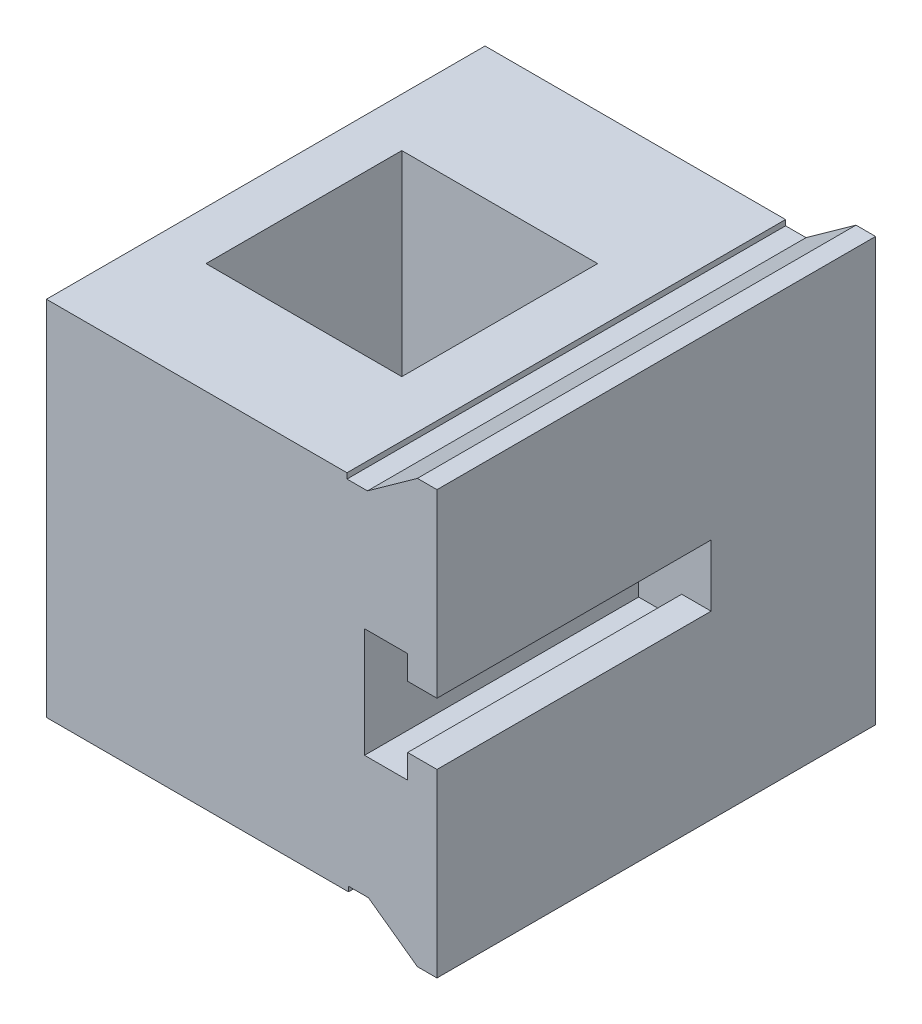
SolidWorks part; units mm, degrees
ref_plane "Alzado" through (0, 0, 0) normal (0, 0, 1) x (1, 0, 0)
ref_plane "Planta" through (0, 0, 0) normal (0, 1, 0) x (1, 0, 0)
ref_plane "Vista lateral" through (0, 0, 0) normal (1, 0, 0) x (0, 0, -1)
sketch "Croquis1" plane through (0, 0, 0) normal (0, 0, 1) x (1, 0, 0)
  line L6 (-5.1354, -16.7583) -> (-0.1354, -16.7583)
  line L7 (-0.1354, -16.7583) -> (-0.2909, 20.2417)
  line L8 (-0.2909, 20.2417) -> (-6.2909, 20.2417)
  line L10 (-0.2885, 19.6836) -> (1.8013, 19.6836)
  line L11 (1.8013, 19.6836) -> (6.9029, 23.3417)
  line L12 (6.9029, 23.3417) -> (8.9029, 23.3417)
  line L13 (8.9029, 23.3417) -> (8.9029, -19.8583)
  line L14 (8.9029, -19.8583) -> (6.9029, -19.8583)
  line L15 (6.9029, -19.8583) -> (1.9029, -16.2583)
  line L16 (1.9029, -16.2583) -> (-0.1375, -16.2583)
  line L17 (-0.1375, -16.2583) -> (-0.2885, 19.6836)
  line L18 (-6.2909, 20.2417) -> (-30.9893, 20.2417)
  line L19 (-30.9893, 20.2417) -> (-30.9893, -16.7583)
  line L20 (-5.1354, -16.7583) -> (-30.9893, -16.7583)
  point P4 (8.9029, 1.7417)
  point P5 (-0.2132, 1.7417)
  dimension "D2" = 215.643
  dimension "D3" = 2.0899
  dimension "D6" = 215.754
  dimension "D7" = 2.0404
  dimension "D8" = 43.2
  dimension "D9" = 2
  dimension "D10" = 2
  dimension "D11" = 6.2776
  dimension "D13" = 5
  dimension "D14" = 6
  dimension "D15" = 180
  dimension "D16" = 180
extrude "Saliente-Extruir1" add sketch "Croquis1" along normal blind 21.8 and the other way blind 23
sketch "Croquis2" plane through (0, 20.2417, 0) normal (0, 1, 0) x (1, 0, 0)
  line L0 (-30.9893, 23) -> (-30.9893, -21.8) construction
  line L1 (-25.9893, 9.5) -> (-5.9893, 9.5)
  line L2 (-25.9893, 9.5) -> (-25.9893, -10.5)
  line L3 (-25.9893, -10.5) -> (-5.9893, -10.5)
  line L4 (-5.9893, 9.5) -> (-5.9893, -10.5)
  line L6 (-0.2909, -21.8) -> (-30.9893, -21.8) construction
  dimension "D1" = 20
  dimension "D2" = 20
  dimension "D3" = 5
  dimension "D4" = 11.3
extrude "Cortar-Extruir1" cut sketch "Croquis2" against normal through all both and the other way through all
sketch "Croquis3" plane through (-30.9893, 0, 0) normal (-1, 0, 0) x (0, 0, 1)
sketch "Croquis4" plane through (-30.9893, 0, 0) normal (-1, 0, 0) x (0, 0, 1)
  circle A0 centre (0, 2.2437) radius 3
  dimension "D1" = 6
extrude "Cortar-Extruir3" cut sketch "Croquis4" against normal blind 10
sketch "Croquis5" plane through (-30.9893, 0, 0) normal (-1, 0, 0) x (0, 0, 1)
  circle A0 centre (0, 2.2437) radius 6.5
  dimension "D1" = 13
extrude "Cortar-Extruir4" cut sketch "Croquis5" against normal blind 2
sketch "Croquis6" plane through (0, 0, 21.8) normal (0, 0, 1) x (1, 0, 0)
  line L0 (8.9029, -1.4083) -> (5.9029, -1.4083)
  line L1 (8.9029, 23.3417) -> (8.9029, -19.8583) construction
  line L2 (5.9029, -1.4083) -> (5.9029, -3.8583)
  line L3 (5.9029, -3.8583) -> (1.5029, -3.8583)
  line L4 (1.5029, -3.8583) -> (1.5029, 7.3417)
  line L5 (1.5029, 7.3417) -> (5.9029, 7.3417)
  line L6 (5.9029, 7.3417) -> (5.9029, 4.8917)
  line L7 (5.9029, 4.8917) -> (8.9029, 4.8917)
  line L8 (8.9029, 4.8917) -> (8.9029, -1.4083)
  line L9 (8.9029, 23.3417) -> (8.9029, -19.8583) construction
  point P14 (8.9029, 1.7417)
  point P15 (8.9029, 1.7417)
  dimension "D1" = 11.2
  dimension "D2" = 6.3
  dimension "D3" = 4.4
  dimension "D4" = 3
extrude "Cortar-Extruir5" cut sketch "Croquis6" against normal blind 28
